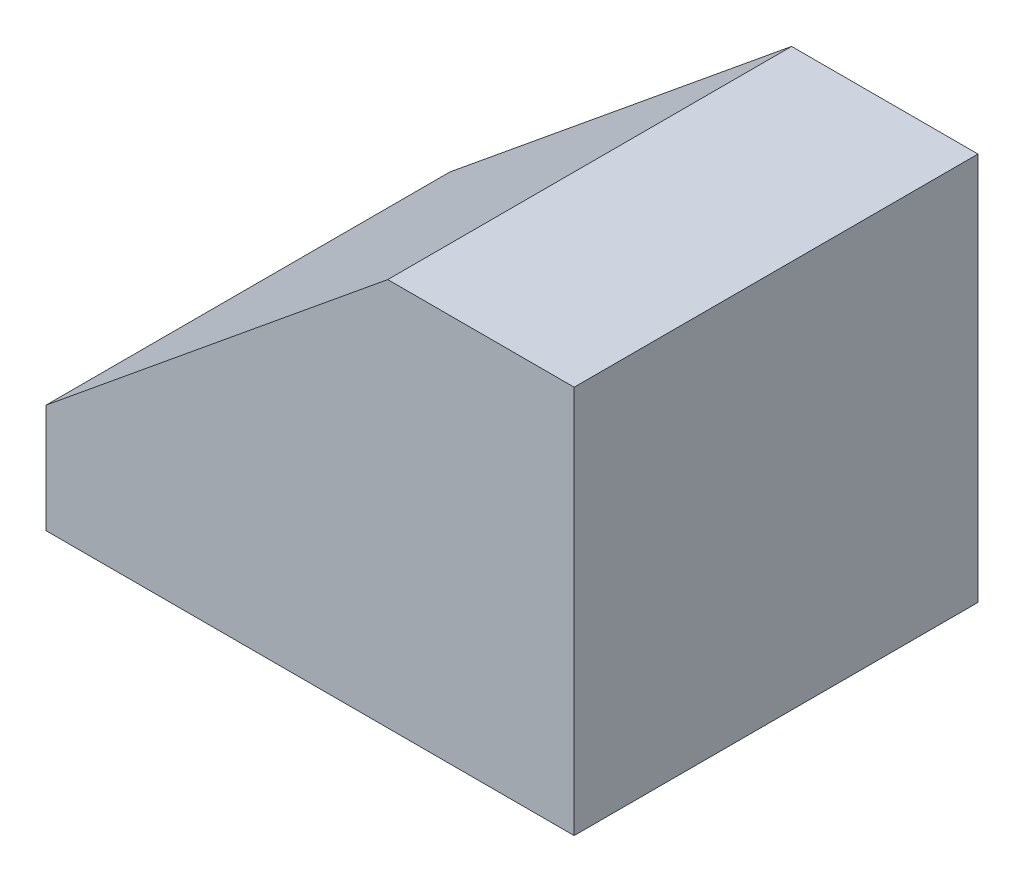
SolidWorks part; units mm, degrees
ref_plane "前视基准面" through (0, 0, 0) normal (0, 0, 1) x (1, 0, 0)
ref_plane "上视基准面" through (0, 0, 0) normal (0, 1, 0) x (1, 0, 0)
ref_plane "右视基准面" through (0, 0, 0) normal (1, 0, 0) x (0, 0, -1)
sketch "草图1" plane through (0, 0, 0) normal (0, 1, 0) x (1, 0, 0)
  line L0 (0, 0) -> (-68, 0)
  line L1 (-68, 0) -> (-68, -52)
  line L2 (-68, -52) -> (0, -52)
  line L3 (0, -52) -> (0, 0)
  dimension "D1" = 68
  dimension "D2" = 52
extrude "凸台-拉伸1" add sketch "草图1" along normal blind 50
sketch "草图2" plane through (0, 0, 0) normal (0, 0, 1) x (1, 0, 0)
  line L0 (-24, 50) -> (-68, 14)
  line L1 (-68, 50) -> (0, 50) construction
  line L2 (-68, 50) -> (-68, 0) construction
  line L3 (-68, 14) -> (-68, 50)
  line L4 (-68, 50) -> (-24, 50)
  dimension "D1" = 24
  dimension "D2" = 14
extrude "切除-拉伸1" cut sketch "草图2" along normal through all
sketch "草图3" plane through (0, 0, 0) normal (1, 0, 0) x (0, 0, -1)
  line L0 (-26, 50) -> (-26, 12.1287) construction
  line L1 (-52, 50) -> (0, 50) construction
  line L2 (-18, 28) -> (-34, 28)
  line L3 (-34, 28) -> (-42, 50)
  line L4 (-42, 50) -> (-10, 50)
  line L5 (-18, 28) -> (-10, 50)
  point P8 (-26, 28)
  dimension "D1" = 22
  dimension "D2" = 16
  dimension "D3" = 8
